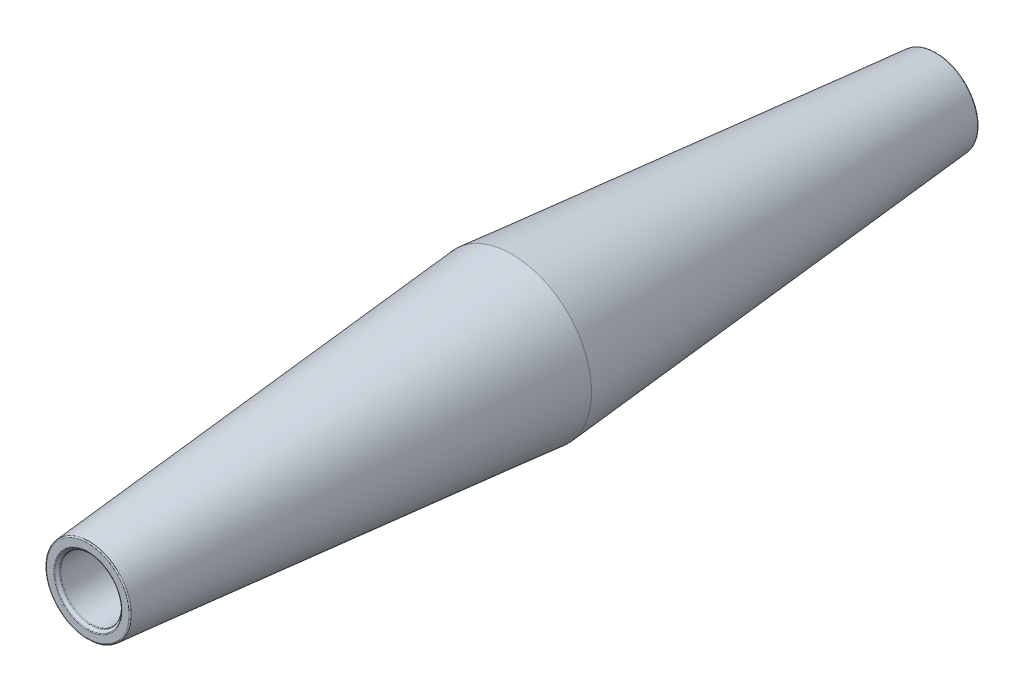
SolidWorks part; units mm, degrees
ref_plane "Ebene vorne" through (0, 0, 0) normal (0, 0, 1) x (1, 0, 0)
ref_plane "Ebene oben" through (0, 0, 0) normal (0, 1, 0) x (1, 0, 0)
ref_plane "Ebene rechts" through (0, 0, 0) normal (1, 0, 0) x (0, 0, -1)
sketch "Skizze1" plane through (0, 0, 0) normal (0, 0, 1) x (1, 0, 0)
  circle A0 centre (0, 0) radius 7
  dimension "D1" = 14
extrude "Aufsatz-Linear austragen1" add sketch "Skizze1" along normal blind 70
draft "Formschräge2" type of draft neutral plane draft angle 5 faces to draft 1 parameters "D1"=5
sketch "Skizze2" plane through (0, 0, 70) normal (0, 0, 1) x (1, 0, 0)
  circle A0 centre (0, 0) radius 5.05
  dimension "D1" = 10.1
extrude "Schnitt-Linear austragen1" cut sketch "Skizze2" against normal blind 68
chamfer "Fase1" distance 0.5 angle 45 1 edges at (5.05, 0, 70)
mirror "Spiegeln3" about plane through (0, 0, 0) normal (0, 0, 1)
fillet "Verrundung1" radius 0.2 9 edges at (13.1242, 0, 0) (7, 0, -70) (5.55, 0, -70) (5.05, 0, -69.5) (5.05, 0, -2) (5.05, 0, 2) (7, 0, 70) (5.55, 0, 70) (5.05, 0, 69.5)
